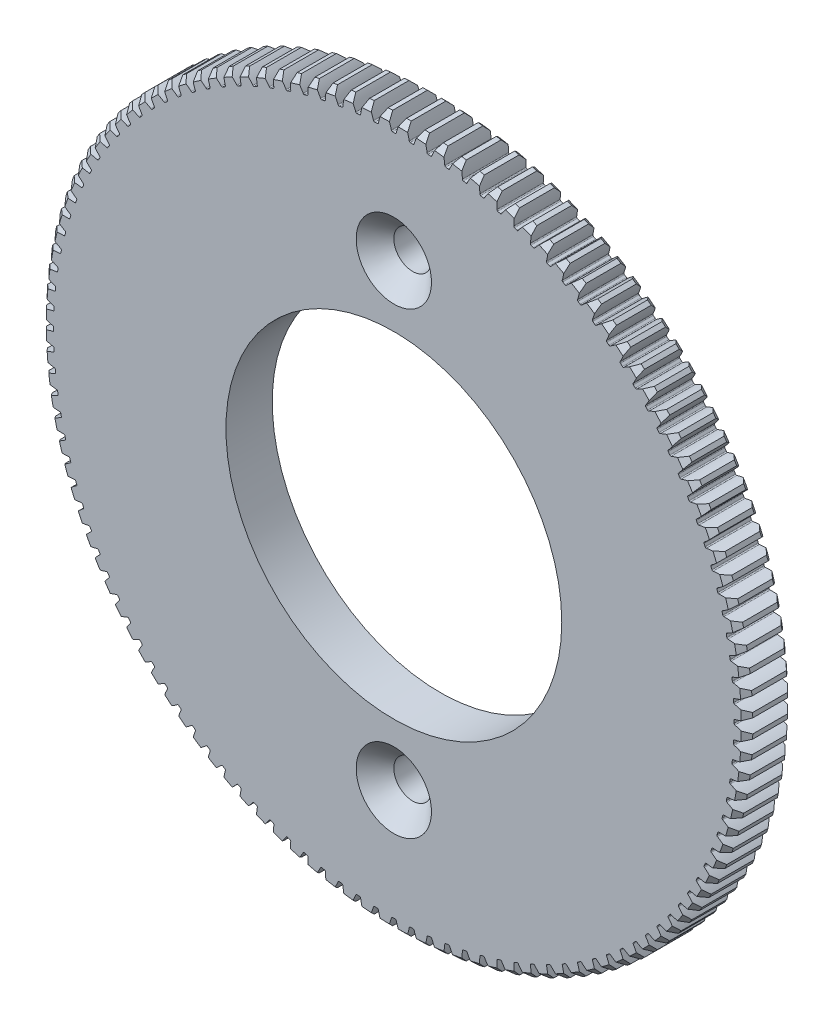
SolidWorks part; units mm, degrees
extrude "Gear Blank" add sketch "Sketch1" along normal mid plane 8
sketch "Sketch1" plane through (0, 0, 0) normal (0, 0, 1) x (1, 0, 0)
  circle A0 centre (0, 0) radius 61
  dimension "D1" = 122
chamfer "Front Gear Chamfer" distance 1 angle 45
ref_plane "Plane1" through (0, 0, 0) normal (0, 0, 1) x (1, 0, 0)
ref_plane "Plane2" through (0, 0, 0) normal (0, 1, 0) x (-1, 0, 0)
ref_plane "Plane3" through (0, 0, 0) normal (1, 0, 0) x (0, 0, -1)
chamfer "Rear Gear Chamfer" distance 1 angle 45
sketch "Sketch2" plane through (0, 0, 0) normal (0, 0, 1) x (1, 0, 0)
  line L0 (0, 61) -> (0, 0) construction
  line L1 (0, 0) -> (9.6524, 0) construction
  line L2 (0, 0) -> (-1.1977, 60.9882) construction
  line L3 (0, 0) -> (1.1976, 60.9882) construction
  line L4 (0, 0) -> (0.3845, 58.7487) construction
  line L5 (0, 0) -> (-0.3845, 58.7487) construction
  arc A1 (1.1976, 60.9882) -> (-1.1977, 60.9882) centre (0, 0) ccw
  arc A2 (1.1976, 60.9882) -> (0.3845, 58.7487) centre (10.1237, 56.4799) ccw
  arc A3 (-1.1977, 60.9882) -> (-0.3845, 58.7487) centre (-10.1238, 56.4799) cw
  arc A4 (-0.3845, 58.7487) -> (0.3845, 58.7487) centre (0, 0) cw
  circle A5 centre (0, 0) radius 61 construction
extrude "Tooth Cut" cut sketch "Sketch2" against normal mid plane 8
fillet "Congé1" radius 0.2
pattern_circular "Tooth Copies" count 120 every 3
sketch "Esquisse1" plane through (0, 0, 4) normal (0, 0, 1) x (1, 0, 0)
  circle A0 centre (0, 0) radius 29
  dimension "D1" = 58
extrude "Enlèv. mat.-Extru.1" cut sketch "Esquisse1" against normal through all
hole_wizard "Fraisage pour vis à tête fraisée à fond plat M61" positions "Esquisse3" profile "Esquisse2" countersink size "M6" standard "ISO"
sketch "Esquisse3" plane through (0, 0, 4) normal (0, 0, 1) x (1, 0, 0)
  line L0 (0, 0) -> (0, 39.6) construction
  circle A0 centre (0, 0) radius 29 construction
  point P0 (0, 39.6)
  dimension "D1" = 39.6
sketch "Esquisse2" plane through (0, 39.6, 4) normal (1, 0, 0) x (0, -1, 0)
  line L0 (0, 0) -> (0, 8)
  line L1 (0, 8) -> (3.25, 8)
  line L2 (3.25, 8) -> (3.25, 3.25)
  line L3 (3.25, 3.25) -> (6.5, 0)
  line L5 (6.5, 0) -> (0, 0)
  line L6 (-3.25, 3.25) -> (-6.5, 0) construction
  line L11 (0, -6.35) -> (0, 107.95) construction
  dimension "Diamètre du perçage jusqu'au prochain" = 6.5
  dimension "Profondeur du perçage jusqu'au prochain" = 8
  dimension "Diamètre du fraisage entrant" = 13
  dimension "Angle du fraisage entrant" = 90
hole_wizard "Perçage1" positions "Esquisse4" profile "Esquisse5" countersink size "M6" standard "ISO"
sketch "Esquisse4" plane through (-0.6974, -61.2941, 4) normal (0, 0, 1) x (1, 0, 0)
  line L0 (0.6974, 61.2941) -> (0.6974, 21.6941) construction
  circle A1 centre (0.6974, 61.2941) radius 29 construction
  point P0 (0.6974, 21.6941)
  dimension "D1" = 39.6
sketch "Esquisse5" plane through (0, -39.6, 4) normal (1, 0, 0) x (0, -1, 0)
  line L0 (0, 0) -> (0, 8)
  line L1 (0, 8) -> (3.25, 8)
  line L2 (3.25, 8) -> (3.25, 3.25)
  line L3 (3.25, 3.25) -> (6.5, 0)
  line L5 (6.5, 0) -> (0, 0)
  line L6 (-3.25, 3.25) -> (-6.5, 0) construction
  line L11 (0, -6.35) -> (0, 107.95) construction
  dimension "Diamètre du perçage jusqu'au prochain" = 6.5
  dimension "Profondeur du perçage jusqu'au prochain" = 8
  dimension "Diamètre du fraisage entrant" = 13
  dimension "Angle du fraisage entrant" = 90
equation "\"D2@Tooth Copies\"=360/\"Nombre de dents@Tooth Copies\""
equation "\"D4@Sketch2\" = (3/4) * \"D2@Tooth Copies\""
equation "\"D5@Sketch2\"= \"D2@Tooth Copies\" - \"D4@Sketch2\""
equation "\"D1@Sketch2\" = \"D1@Sketch1\" - 4.5"
equation "\"D1@Tooth Cut\" = \"D1@Gear Blank\""
